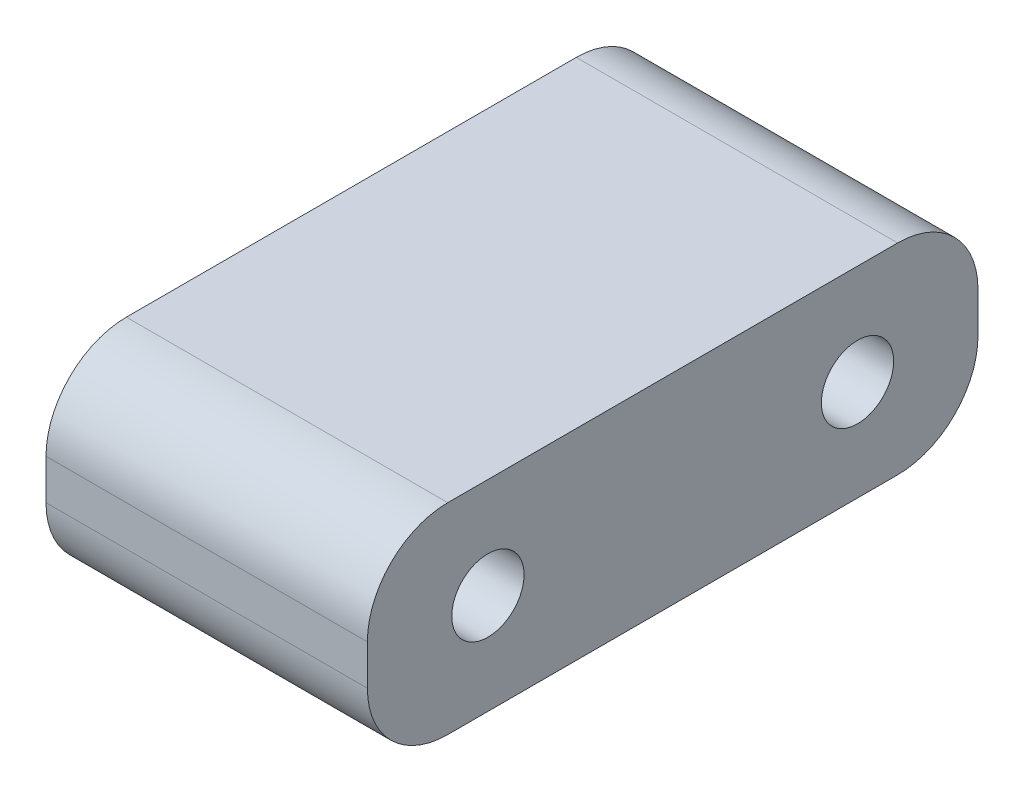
SolidWorks part; units mm, degrees
ref_plane "Front Plane" through (0, 0, 0) normal (0, 0, 1) x (1, 0, 0)
ref_plane "Top Plane" through (0, 0, 0) normal (0, 1, 0) x (1, 0, 0)
ref_plane "Right Plane" through (0, 0, 0) normal (1, 0, 0) x (0, 0, -1)
imported_body "Stock-Race Car 1-1"
sketch "Sketch1" plane through (10, 0, 0) normal (1, 0, 0) x (0, 0, -1)
  line L0 (2.75, 13.0314) -> (32.75, 13.0314) construction
  line L1 (17.0838, 0.5314) -> (19.0838, 0.5314)
  line L2 (17.0838, 0.5314) -> (17.0838, 13.0314)
  line L3 (17.0838, 13.0314) -> (19.0838, 13.0314)
  line L4 (19.0838, 0.5314) -> (19.0838, 13.0314)
  line L5 (17.0838, 0.5314) -> (19.0838, 13.0314) construction
  line L6 (17.0838, 13.0314) -> (19.0838, 0.5314) construction
  point P0 (18.0838, 6.7814)
extrude "Cut-Extrude1" cut sketch "Sketch1" against normal through all
move or copy body "Body-Move/Copy1" bodies to move or copy 103 copy no translate (0, 0, 2)
combine bodies "Combine1" operation type add bodies to combine 104 102
